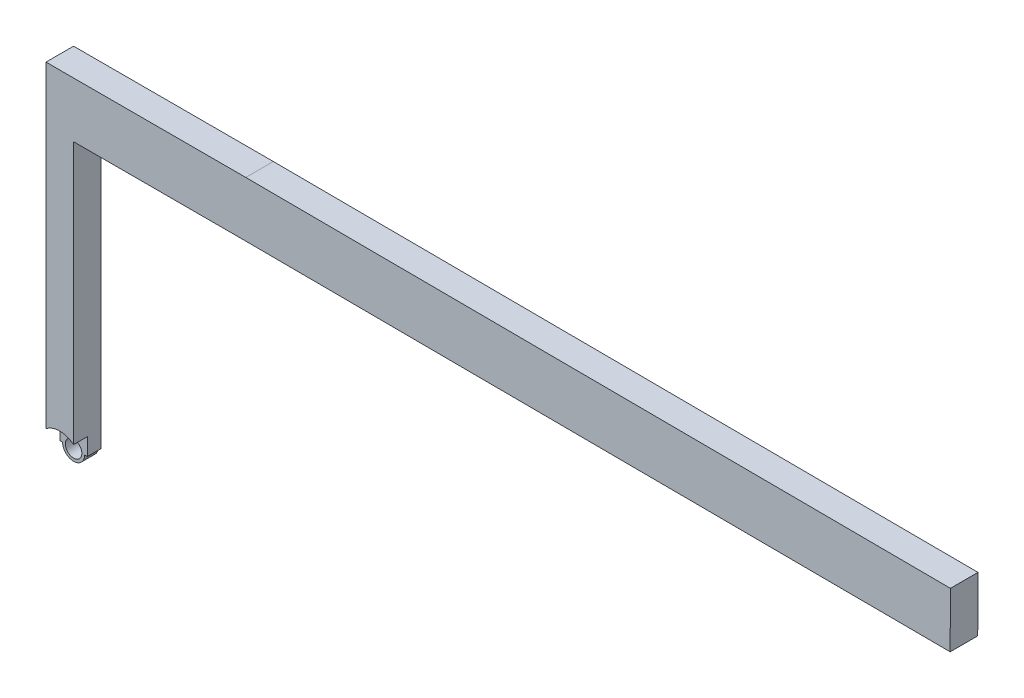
SolidWorks part; units mm, degrees
ref_plane "Front Plane" through (0, 0, 0) normal (0, 0, 1) x (1, 0, 0)
ref_plane "Top Plane" through (0, 0, 0) normal (0, 1, 0) x (1, 0, 0)
ref_plane "Right Plane" through (0, 0, 0) normal (1, 0, 0) x (0, 0, -1)
sketch "Sketch2" plane through (0, 0, 0) normal (0, 0, 1) x (1, 0, 0)
  line L0 (0, 0) -> (0, 13.3821)
  line L1 (0, 13.3821) -> (7.9244, 13.3821)
  line L2 (8.6425, 13.3821) -> (40.3675, 13.2204) construction
  line L3 (40.3804, 15.7603) -> (40.3675, 13.2204) construction
  spline S0 degree 3 poles (7.9244, 13.3821) (18.7388, 13.3282) (29.5531, 13.2743) (40.3675, 13.2204) knots 0 0 0 0 1 1 1 1
extrude "Extrude-Thin1" add sketch "Sketch2" along normal blind 1.27 thin
sketch "Sketch3" plane through (0, 0, 1.27) normal (0, 0, 1) x (1, 0, 0)
  line L0 (-1.27, 0) -> (-1.27, 15.9221)
  line L1 (0, 0) -> (-2.54, 0) construction
  line L2 (-2.54, 15.9221) -> (7.9308, 15.9221) construction
extrude "Extrude1" cut sketch "Sketch3" against normal through all and the other way through all
sketch "Sketch4" plane through (0, 0, 1.27) normal (0, 0, 1) x (1, 0, 0)
  circle A0 centre (-0.635, 0.508) radius 0.381
extrude "Extrude2" cut sketch "Sketch4" against normal through all
sketch "Sketch8" plane through (0, 0, 0) normal (1, 0, 0) x (0, 0, -1)
  line L0 (-0.635, 0) -> (-0.635, 1.016)
  line L1 (-1.27, 0) -> (0, 0) construction
  line L2 (-0.635, 1.016) -> (-1.27, 1.016)
  line L3 (-1.27, 0) -> (-1.27, 13.3821) construction
extrude "Extrude6" cut sketch "Sketch8" against normal through all
sketch "Sketch9" plane through (0, 0, 1.27) normal (0, 0, 1) x (1, 0, 0)
  circle A0 centre (-0.635, 0.508) radius 1.016
extrude "Extrude7" cut sketch "Sketch9" against normal up to surface (0.635 mm away)
sketch "Sketch11" plane through (0, 0, 0.635) normal (0, 0, 1) x (1, 0, 0)
  line L0 (0, 0) -> (-1.27, 0) construction
  line L1 (-1.143, 0.508) -> (-1.27, 0.508)
  line L2 (-1.27, 0) -> (-1.27, 1.3011) construction
  line L3 (-0.127, 0.508) -> (0, 0.508)
  line L4 (0, 0) -> (0, 1.3011) construction
  arc A0 (-0.635, 0) -> (-1.143, 0.508) centre (-0.635, 0.508) cw
  arc A1 (-0.635, 0) -> (-0.127, 0.508) centre (-0.635, 0.508) ccw
extrude "Extrude9" cut sketch "Sketch11" against normal through all and the other way through all flip side to cut
